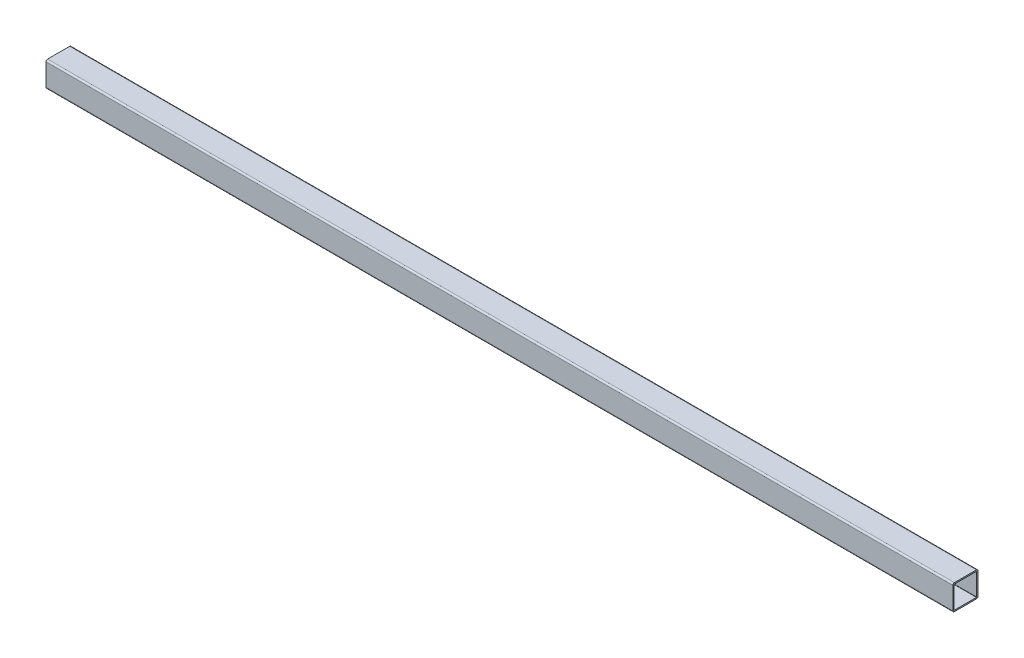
SolidWorks part; units mm, degrees
ref_plane "Front Plane" through (0, 0, 0) normal (0, 0, 1) x (1, 0, 0)
ref_plane "Top Plane" through (0, 0, 0) normal (0, 1, 0) x (1, 0, 0)
ref_plane "Right Plane" through (0, 0, 0) normal (1, 0, 0) x (0, 0, -1)
sketch "Sketch1" plane through (0, 0, 0) normal (1, 0, 0) x (0, 0, -1)
  line L0 (-5.373, 3.898) -> (16.852, 3.898)
  line L1 (-5.373, 5.2442) -> (16.852, 5.2442)
  line L2 (-6.9605, 3.6567) -> (-6.9605, -18.5683)
  line L3 (-5.373, -20.1558) -> (16.852, -20.1558)
  line L4 (18.4395, 3.6567) -> (18.4395, -18.5683)
  line L5 (17.0933, 3.6567) -> (17.0933, -18.5683)
  line L6 (-5.373, -18.8096) -> (16.852, -18.8096)
  line L7 (-5.6143, 3.6567) -> (-5.6143, -18.5683)
  arc A0 (16.852, 5.2442) -> (18.4395, 3.6567) centre (16.852, 3.6567) cw
  arc A1 (-6.9605, 3.6567) -> (-5.373, 5.2442) centre (-5.373, 3.6567) cw
  arc A2 (-5.373, -20.1558) -> (-6.9605, -18.5683) centre (-5.373, -18.5683) cw
  arc A3 (18.4395, -18.5683) -> (16.852, -20.1558) centre (16.852, -18.5683) cw
  arc A4 (16.852, 3.898) -> (17.0933, 3.6567) centre (16.852, 3.6567) cw
  arc A5 (17.0933, -18.5683) -> (16.852, -18.8096) centre (16.852, -18.5683) cw
  arc A6 (-5.373, -18.8096) -> (-5.6143, -18.5683) centre (-5.373, -18.5683) cw
  arc A7 (-5.6143, 3.6567) -> (-5.373, 3.898) centre (-5.373, 3.6567) cw
  point P6 (18.4395, 5.2442)
  point P9 (-6.9605, 5.2442)
  point P14 (18.4395, -20.1558)
  dimension "D3" = 1.5875
  dimension "D1" = 25.4
  dimension "D2" = 25.4
  dimension "D4" = 1.3462
extrude "Extrude1" add sketch "Sketch1" along normal blind 914.4
